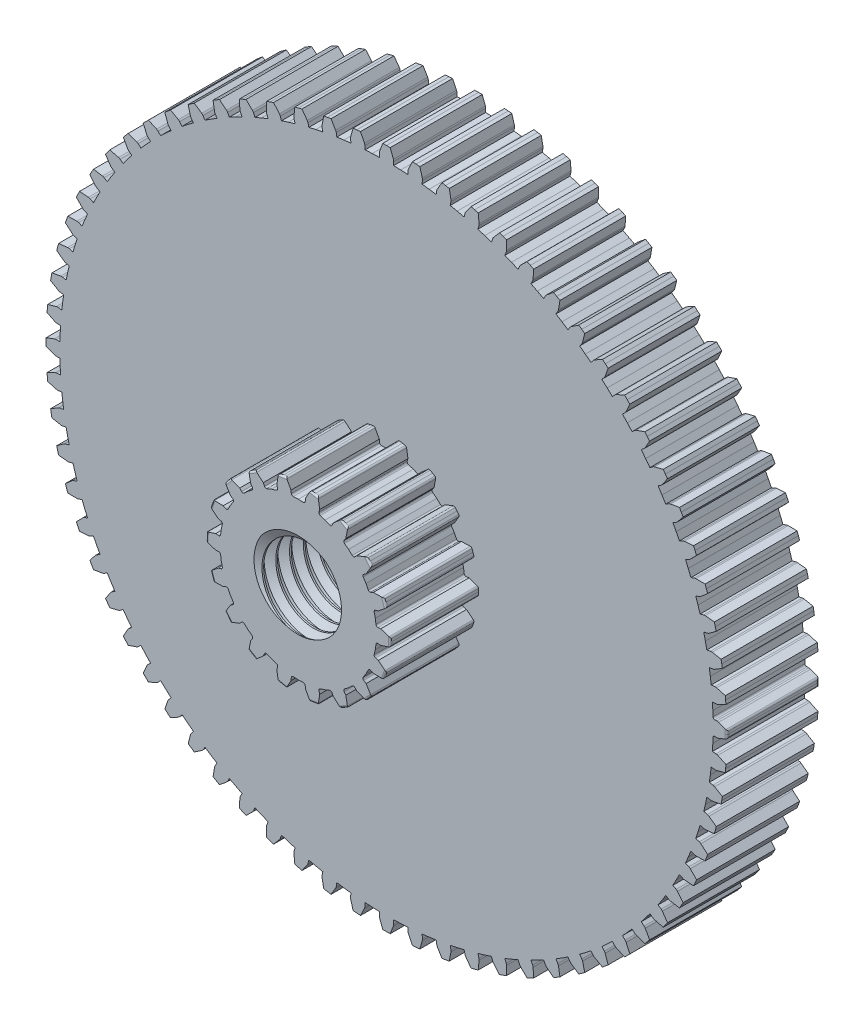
SolidWorks part; units mm, degrees
ref_plane "Front Plane" through (0, 0, 0) normal (0, 0, 1) x (1, 0, 0)
ref_plane "Top Plane" through (0, 0, 0) normal (0, 1, 0) x (1, 0, 0)
ref_plane "Right Plane" through (0, 0, 0) normal (1, 0, 0) x (0, 0, -1)
imported_body "Gear22-1-solid1"
imported_body "Gear12-1-solid1"
sketch "Esquisse15" plane through (0, 0, 9.5894) normal (0, 0, -1) x (-1, 0, 0)
  circle A0 centre (0, 0) radius 4.25 construction
  circle A1 centre (0, 0) radius 4.25
extrude "Boss.-Extru.1" add sketch "Esquisse15" along normal through all
sketch "Esquisse16" plane through (0, 0, 9.5894) normal (0, 0, 1) x (1, 0, 0)
  circle A1 centre (0, 0) radius 4.25
  circle A2 centre (0, 0) radius 4.25
  dimension "D1" = 0
extrude "Boss.-Extru.3" add sketch "Esquisse16" along normal through all
sketch "Esquisse18" plane through (0, 0, 0) normal (0, 0, -1) x (-1, 0, 0)
  circle A0 centre (0, 0) radius 4.25
  dimension "D1" = 8.5
extrude "Enlèv. mat.-Extru.4" cut sketch "Esquisse18" against normal blind 23
thread "Filetage1" pitch 1.5 start angle 0, offset 4, length 30, pitch 1.5, diameter 8.5
ref_plane "Plan1" through (-4.25, 0, 23.5894) normal (0, -1, 0) x (-1, 0, 0)
sketch "Profil de filetage1" plane through (-4.25, 0, 23.5894) normal (0, -1, 0) x (-1, 0, 0)
  line L0 (0, 0) -> (0, 1.5) construction
  line L11 (0, 1.3125) -> (0, 0)
  line L12 (0, 0) -> (0.8119, 0.4688)
  line L13 (0.8119, 0.4688) -> (0.8119, 0.8438)
  line L15 (0.8119, 0.8438) -> (0, 1.3125)
  line L17 (0.8119, 0.6563) -> (0, 0.6563) construction
  point P3 (0, 0)
  dimension "Pitch" = 1.5
  dimension "Profile_Angle" = 60
  dimension "Profile_Land" = 0.375
  dimension "Profile_Height" = 0.8119
